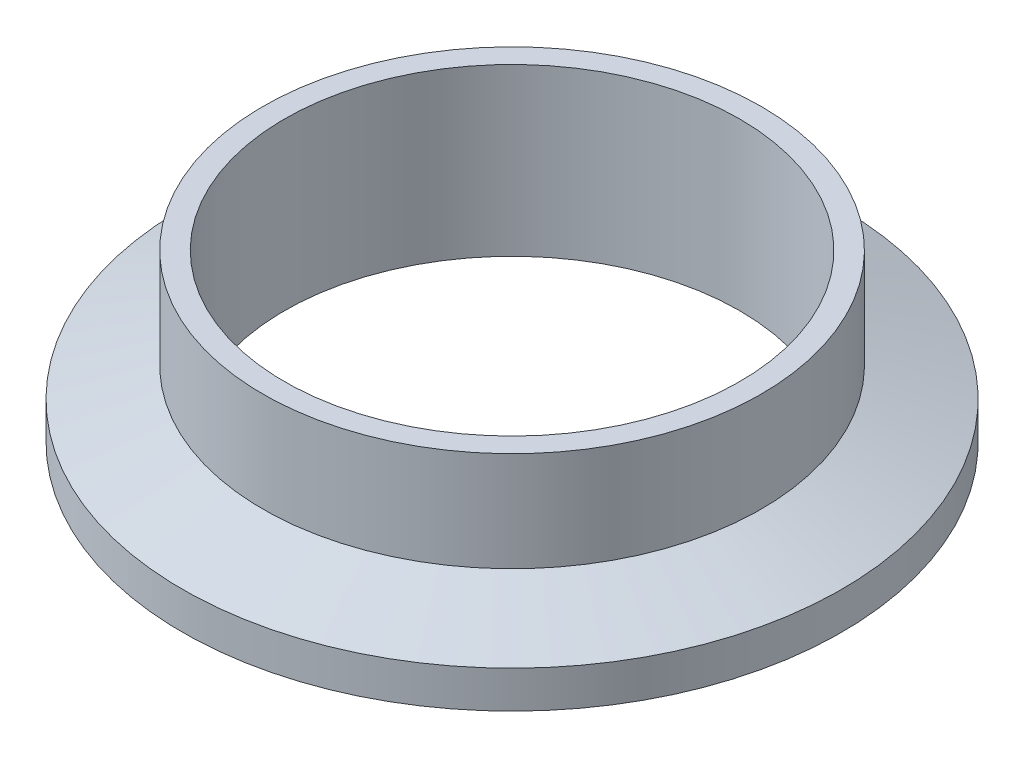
SolidWorks part; units mm, degrees
ref_plane "Front Plane" through (0, 0, 0) normal (0, 0, 1) x (1, 0, 0)
ref_plane "Top Plane" through (0, 0, 0) normal (0, 1, 0) x (1, 0, 0)
ref_plane "Right Plane" through (0, 0, 0) normal (1, 0, 0) x (0, 0, -1)
sketch "Sketch1" plane through (0, 0, 0) normal (0, 0, 1) x (1, 0, 0)
  line L0 (0, 0) -> (0, 12.7) construction
  line L1 (0, 12.7) -> (-19.05, 12.7)
  line L2 (-19.05, 12.7) -> (-19.05, 5.0821)
  line L3 (-19.05, 5.0821) -> (-25.1968, 2.8448)
  line L4 (-25.1968, 2.8448) -> (-25.1968, 0)
  line L5 (-25.1968, 0) -> (-23.9522, 0)
  line L6 (-20.0116, 0) -> (0, 0)
  line L7 (0, 0) -> (0, 12.7)
  line L8 (0, 12.7) -> (-17.399, 12.7)
  line L9 (-17.399, 12.7) -> (-17.399, 0)
  line L10 (-17.399, 0) -> (0, 0)
  line L11 (0, 0) -> (-0.1846, 0.0129)
  line L12 (-23.2507, 0.4643) -> (-23.0773, 0.8729)
  line L13 (-20.9336, 0.984) -> (-20.713, 0.4643)
  arc A0 (-23.0773, 0.8729) -> (-20.9336, 0.984) centre (-21.9784, 0.4064) cw
  arc A1 (-23.2507, 0.4643) -> (-23.9522, 0) centre (-23.9522, 0.762) cw
  arc A2 (-20.713, 0.4643) -> (-20.0116, 0) centre (-20.0116, 0.762) ccw
  point P12 (-20.6248, 0)
  dimension "D5" = 0.4064
  dimension "D10" = 1.1938
  dimension "D11" = 0.762
  dimension "D12" = 0.762
  dimension "D1" = 19.05
  dimension "D2" = 2.8448
  dimension "D3" = 25.1968
  dimension "D4" = 70
  dimension "D8" = 1.651
  dimension "D9" = 12.7
revolve "Revolve2" add sketch "Sketch1" angle 360 about L0
